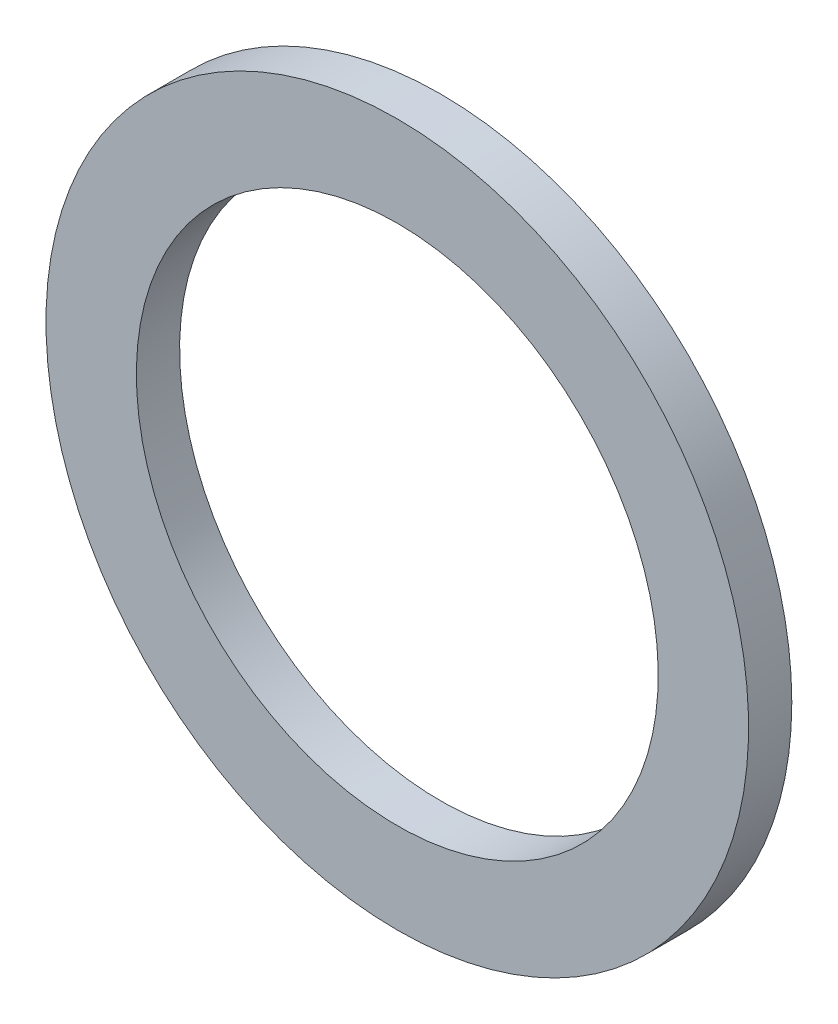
SolidWorks part; units mm, degrees
ref_plane "Face" through (0, 0, 0) normal (0, 0, 1) x (1, 0, 0)
ref_plane "Dessus" through (0, 0, 0) normal (0, 1, 0) x (1, 0, 0)
ref_plane "Droite" through (0, 0, 0) normal (1, 0, 0) x (0, 0, -1)
sketch "Esquisse1" plane through (0, 0, 0) normal (0, 0, 1) x (1, 0, 0)
  circle A1 centre (-0.5302, 200.1278) radius 16.2594
  circle A3 centre (-0.5302, 200.1278) radius 12.0765
extrude "Boss.-Extru.1" add sketch "Esquisse1" along normal up to surface (2 mm away)
